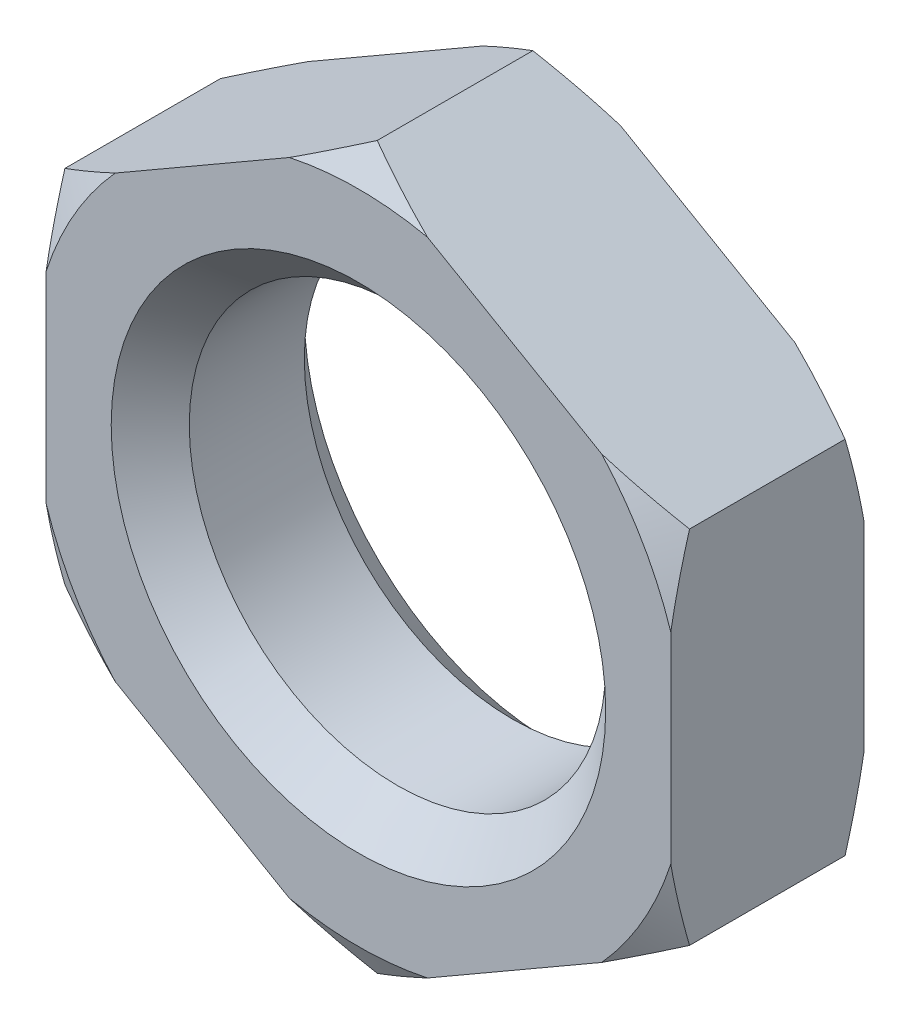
SolidWorks part; units mm, degrees
ref_plane "Front Plane" through (0, 0, 0) normal (0, 0, 1) x (1, 0, 0)
ref_plane "Top Plane" through (0, 0, 0) normal (0, 1, 0) x (1, 0, 0)
ref_plane "Right Plane" through (0, 0, 0) normal (1, 0, 0) x (0, 0, -1)
sketch "Sketch1" plane through (0, 0, 0) normal (0, 0, 1) x (1, 0, 0)
  line L1 (0, 13.8564) -> (-12, 6.9282)
  line L2 (-12, 6.9282) -> (-12, -6.9282)
  line L3 (-12, -6.9282) -> (0, -13.8564)
  line L4 (0, -13.8564) -> (12, -6.9282)
  line L5 (12, -6.9282) -> (12, 6.9282)
  line L6 (12, 6.9282) -> (0, 13.8564)
  circle A0 centre (0, 0) radius 12 construction
  circle A1 centre (0, 0) radius 8
  dimension "D2" = 16
  dimension "D1" = 24
extrude "Boss-Extrude1" add sketch "Sketch1" along normal mid plane 7.42
sketch "Sketch2" plane through (0, 0, 0) normal (1, 0, 0) x (0, 0, -1)
  line L0 (7.477, 0) -> (-8.5759, 0) construction
sketch "Sketch3" plane through (0, 0, 0) normal (1, 0, 0) x (0, 0, -1)
  line L0 (-3.71, 13.8564) -> (-3.71, 12.6064)
  line L1 (-3.71, 6.9282) -> (-3.71, 13.8564) construction
  line L2 (-3.71, 12.6064) -> (-2.9883, 13.8564)
  line L3 (-3.71, 13.8564) -> (3.71, 13.8564) construction
  line L4 (-2.9883, 13.8564) -> (-3.71, 13.8564)
  dimension "D1" = 1.25
  dimension "D2" = 30
revolve "Cut-Revolve1" cut sketch "Sketch3" angle 360 about L0
mirror "Mirror1" about plane through (0, 0, 0) normal (0, 0, 1) of "Cut-Revolve1"
chamfer "Chamfer1" distance 1.5 angle 45 2 edges at (8, 0, -3.71) (8, 0, 3.71)
